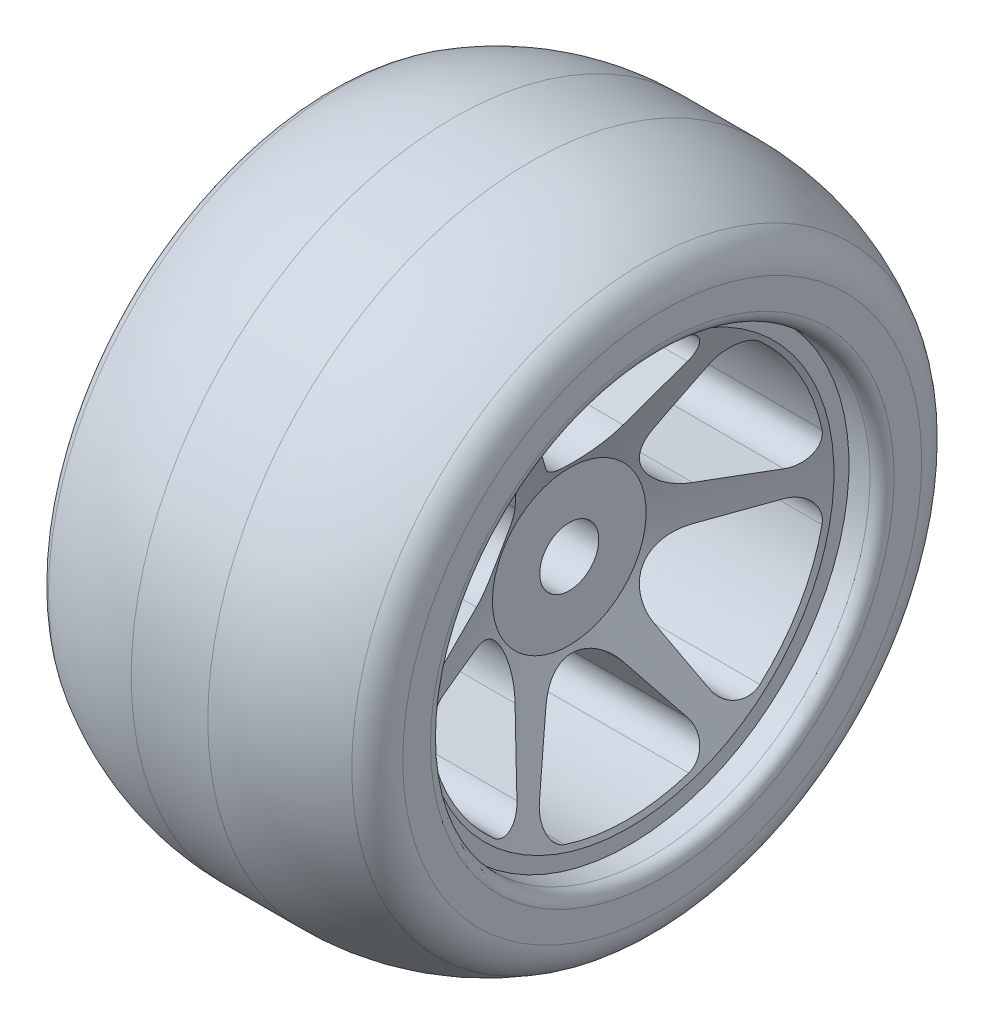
SolidWorks part; units mm, degrees
ref_plane "Front Plane" through (0, 0, 0) normal (0, 0, 1) x (1, 0, 0)
ref_plane "Top Plane" through (0, 0, 0) normal (0, 1, 0) x (1, 0, 0)
ref_plane "Right Plane" through (0, 0, 0) normal (1, 0, 0) x (0, 0, -1)
sketch "Sketch1" plane through (0, 0, 0) normal (0, 0, 1) x (1, 0, 0)
  line L0 (0, 0) -> (47.056, 0) construction
  line L1 (0, 5) -> (33.528, 5)
  line L2 (33.528, 5) -> (33.528, 13.0175)
  line L3 (33.528, 13.0175) -> (43.688, 34.671)
  line L4 (43.688, 34.671) -> (43.688, 37.211)
  line L5 (43.688, 37.211) -> (0, 37.211)
  line L6 (0, 37.211) -> (0, 5)
  line L7 (43.688, 37.211) -> (49.276, 37.211)
  line L8 (49.276, 37.211) -> (49.276, 47.371)
  line L9 (0, 37.211) -> (-8.382, 37.211)
  line L10 (-8.382, 37.211) -> (-8.382, 47.371)
  line L11 (13.961, 54.61) -> (26.933, 54.61)
  line L12 (20.447, 54.61) -> (20.447, 0) construction
  arc A0 (-8.382, 47.371) -> (13.961, 54.61) centre (13.961, 16.51) cw
  arc A1 (26.933, 54.61) -> (49.276, 47.371) centre (26.933, 16.51) cw
  dimension "D13" = 28.829
  dimension "D12" = 38.1
  dimension "D1" = 10.16
  dimension "D2" = 10
  dimension "D3" = 74.422
  dimension "D4" = 26.035
  dimension "D5" = 43.688
  dimension "D6" = 33.528
  dimension "D7" = 2.54
  dimension "D8" = 57.658
  dimension "D9" = 8.382
  dimension "D10" = 5.588
  dimension "D11" = 109.22
  dimension "D14" = 28.829
  dimension "D15" = 15.748
sketch "Sketch2" plane through (0, 0, 0) normal (0, 0, 1) x (1, 0, 0)
  line L0 (0, 5) -> (33.528, 5) construction
  line L1 (33.528, 5) -> (33.528, 13.0175) construction
  line L2 (33.528, 13.0175) -> (43.688, 34.671) construction
  line L3 (43.688, 34.671) -> (43.688, 37.211) construction
  line L4 (43.688, 37.211) -> (0, 37.211) construction
  line L5 (0, 37.211) -> (0, 5) construction
  line L6 (0, 5) -> (33.528, 5)
  line L7 (33.528, 5) -> (33.528, 13.0175)
  line L8 (33.528, 13.0175) -> (43.688, 34.671)
  line L9 (43.688, 34.671) -> (43.688, 37.211)
  line L10 (43.688, 37.211) -> (0, 37.211)
  line L11 (0, 37.211) -> (0, 5)
revolve "Revolve1" add sketch "Sketch2" angle 360 mid plane about L0
sketch "Sketch4" plane through (0, 0, 0) normal (0, 0, 1) x (1, 0, 0)
  line L0 (43.688, 37.211) -> (0, 37.211) construction
  line L1 (43.688, 37.211) -> (49.276, 37.211) construction
  line L2 (49.276, 37.211) -> (49.276, 47.371) construction
  line L3 (13.961, 54.61) -> (26.933, 54.61) construction
  line L4 (-8.382, 37.211) -> (-8.382, 47.371) construction
  line L5 (0, 37.211) -> (-8.382, 37.211) construction
  line L6 (43.688, 37.211) -> (0, 37.211)
  line L7 (43.688, 37.211) -> (49.276, 37.211)
  line L8 (49.276, 37.211) -> (49.276, 47.371)
  line L9 (13.961, 54.61) -> (26.933, 54.61)
  line L10 (-8.382, 37.211) -> (-8.382, 47.371)
  line L11 (0, 37.211) -> (-8.382, 37.211)
  arc A0 (49.276, 47.371) -> (26.933, 54.61) centre (26.933, 16.51) ccw construction
  arc A1 (13.961, 54.61) -> (-8.382, 47.371) centre (13.961, 16.51) ccw construction
  arc A2 (49.276, 47.371) -> (26.933, 54.61) centre (26.933, 16.51) ccw
  arc A3 (13.961, 54.61) -> (-8.382, 47.371) centre (13.961, 16.51) ccw
revolve "Revolve2" add sketch "Sketch4" angle 360 mid plane about L0
fillet "Fillet1" radius 6.35 2 edges at (-8.382, 0, 47.371) (49.276, 0, 47.371)
fillet "Fillet2" radius 2.032 2 edges at (49.276, 0, 37.211) (-8.382, 0, 37.211)
sketch "Sketch5" plane through (0, 0, 0) normal (1, 0, 0) x (0, 0, -1)
  line L0 (0, 0) -> (0, 33.782) construction
  line L1 (-12.537, 26.0982) -> (-6.532, 17.3568)
  line L2 (6.532, 17.3568) -> (12.537, 26.0982)
  arc A0 (-6.532, 17.3568) -> (6.532, 17.3568) centre (0, 21.844) ccw
  arc A1 (10.5029, 32.1078) -> (-10.5029, 32.1078) centre (0, 0) ccw
  arc A2 (-10.5029, 32.1078) -> (-12.537, 26.0982) centre (-9.271, 28.3418) ccw
  arc A3 (12.537, 26.0982) -> (10.5029, 32.1078) centre (9.271, 28.3418) ccw
  dimension "D1" = 7.9248
  dimension "D3" = 33.782
  dimension "D4" = 3.9624
  dimension "D6" = 26.4668
  dimension "D8" = 19.8628
  dimension "D2" = 21.844
  dimension "D5" = 18.542
  dimension "D7" = 13.9192
extrude "Cut-Extrude1" cut sketch "Sketch5" against normal blind 12.7 and the other way blind 50.8
pattern_circular "CirPattern1" count 6 over 360 about axis through (0, 0, 0) along (1, 0, 0) of "Cut-Extrude1"
ref_plane "Pl-tire-center" through (20.447, 0, 0) normal (1, 0, 0) x (0, 0, -1)
sketch "Sketch6" [suppressed] plane through (0, 0, 0) normal (1, 0, 0) x (0, 0, -1)
  line L0 (0, 0) -> (0, 25.4)
  line L1 (0, 0) -> (21.997, -12.7)
  line L2 (0, 0) -> (-21.997, -12.7)
  circle A0 centre (0, 25.4) radius 6.35
  circle A1 centre (21.997, -12.7) radius 6.35
  circle A2 centre (-21.997, -12.7) radius 6.35
  circle A3 centre (0, 25.4) radius 2.3876
  circle A4 centre (21.997, -12.7) radius 2.3876
  circle A5 centre (-21.997, -12.7) radius 2.3876
  circle A6 centre (-21.997, -12.7) radius 3.9624
  circle A7 centre (21.997, -12.7) radius 3.9624
  circle A8 centre (0, 25.4) radius 3.9624
  dimension "D4" = 12.7
  dimension "D5" = 4.7752
  dimension "D6" = 7.9248
  dimension "D1" = 120
  dimension "D2" = 120
  dimension "D3" = 25.4
